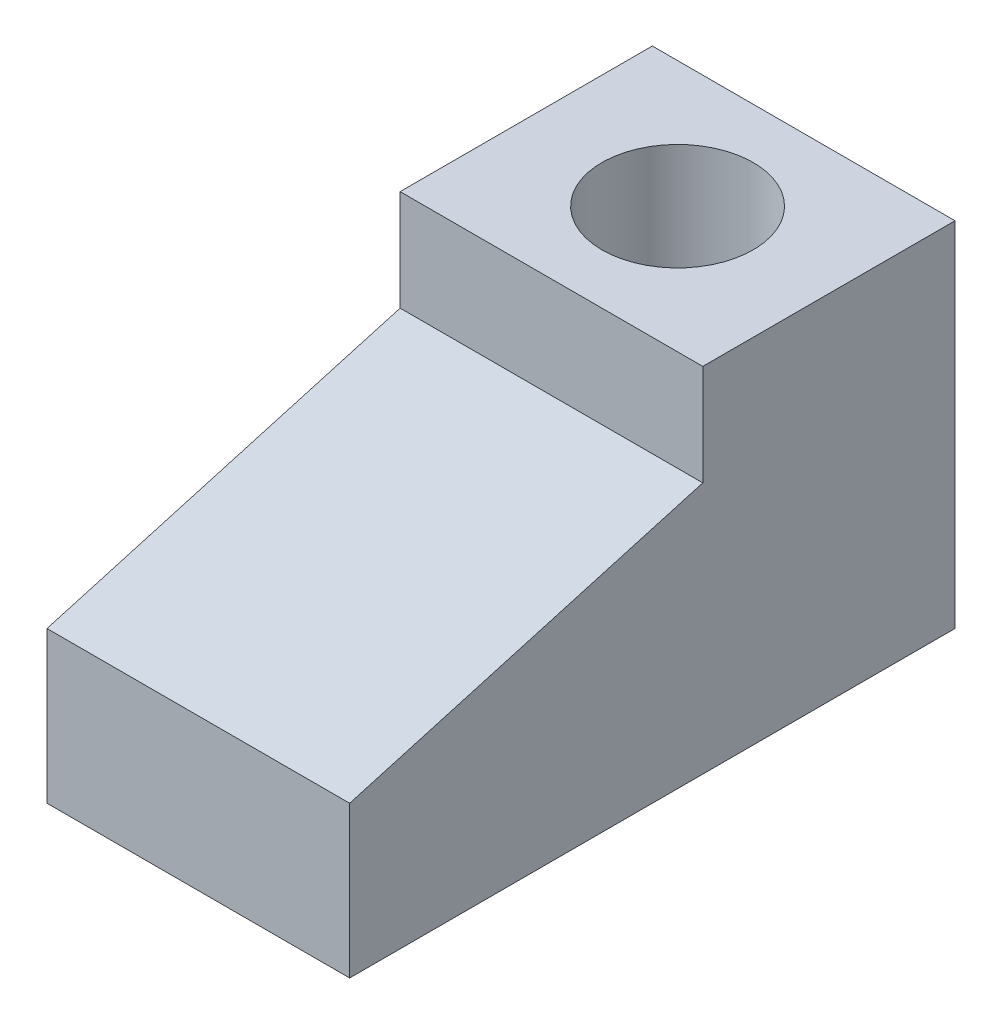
SolidWorks part; units mm, degrees
ref_plane "Front Plane" through (0, 0, 0) normal (0, 0, 1) x (1, 0, 0)
ref_plane "Top Plane" through (0, 0, 0) normal (0, 1, 0) x (1, 0, 0)
ref_plane "Right Plane" through (0, 0, 0) normal (1, 0, 0) x (0, 0, -1)
ref_plane "Plane1" through (4, 0, 0) normal (1, 0, 0) x (0, 0, -1)
sketch "Sketch2" plane through (4, 0, 0) normal (1, 0, 0) x (0, 0, -1)
  line L0 (-2, 3) -> (10, 3)
  line L1 (10, 3) -> (10, 10)
  line L2 (10, 10) -> (5, 10)
  line L3 (5, 10) -> (5, 8)
  line L4 (5, 8) -> (-2, 6)
  line L5 (-2, 6) -> (-2, 3)
  dimension "D1" = 2
  dimension "D2" = 3
  dimension "D3" = 3
  dimension "D4" = 7
  dimension "D5" = 5
  dimension "D6" = 2
  dimension "D7" = 7
extrude "Extrude1" add sketch "Sketch2" along normal blind 6
other "Hole1"
sketch "Sketch3" plane through (0, 10, 0) normal (0, 1, 0) x (-1, 0, 0)
  line L0 (-4, -10) -> (-4, -5) construction
  line L1 (-10, -10) -> (-4, -10) construction
  circle A0 centre (-7, -7.5) radius 1.5
  dimension "D1" = 3
  dimension "D2" = 3
  dimension "D3" = 2.5
